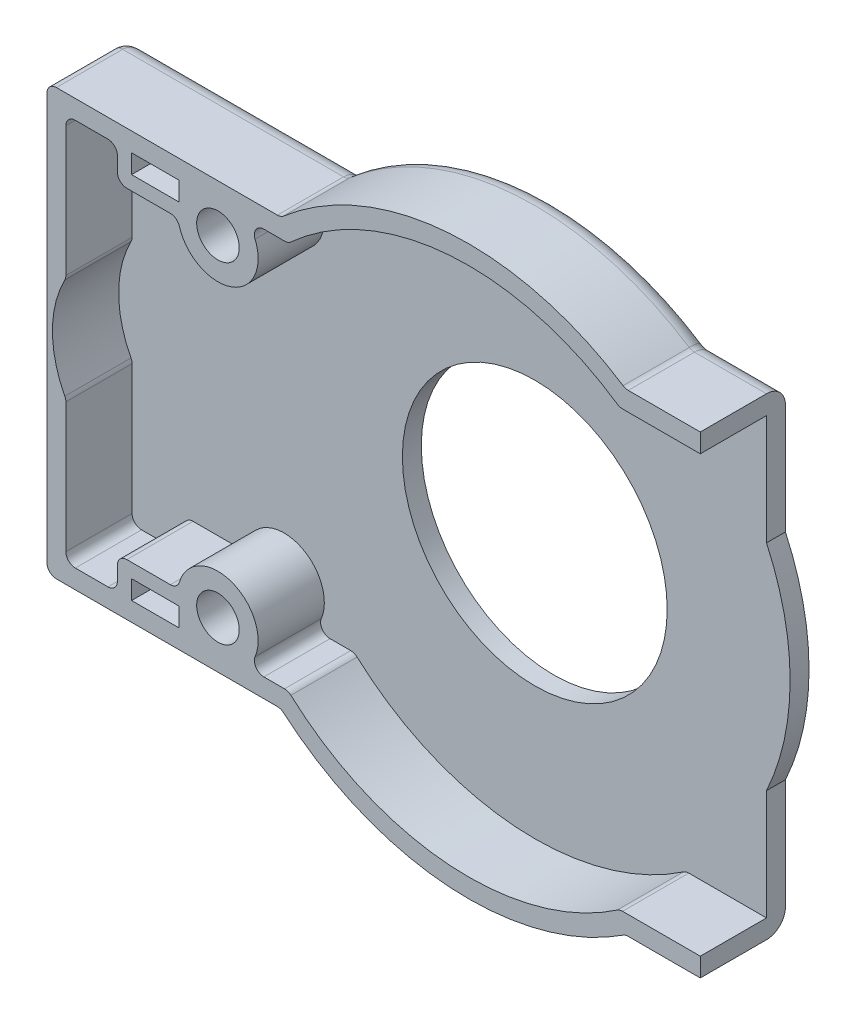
SolidWorks part; units mm, degrees
ref_plane "Спереди" through (0, 0, 0) normal (0, 0, 1) x (1, 0, 0)
ref_plane "Сверху" through (0, 0, 0) normal (0, 1, 0) x (1, 0, 0)
ref_plane "Справа" through (0, 0, 0) normal (1, 0, 0) x (0, 0, -1)
sketch "Эскиз1" plane through (0, 0, 0) normal (0, 0, 1) x (1, 0, 0)
  line L0 (0, 0) -> (24.5, 0) construction
  line L1 (24.5, -25) -> (24.5, -11.3468)
  line L2 (24.5, 25) -> (16.5831, 25)
  line L3 (24.5, -25) -> (16.5831, -25)
  line L4 (16.5831, 25) -> (-16.5831, 25) construction
  line L5 (16.5831, -25) -> (-16.5831, -25) construction
  line L6 (-16.5831, -22.5) -> (-16.5831, 22.5) construction
  line L7 (-16.5831, 0) -> (0, 0) construction
  line L8 (-16.5831, 22.5) -> (-19.8431, 22.5) construction
  line L9 (-16.5831, -22.5) -> (-19.8431, -22.5) construction
  line L10 (-19.8431, 22.5) -> (-44.5831, 22.5)
  line L11 (-44.5831, 22.5) -> (-44.5831, -22.5)
  line L12 (-44.5831, -22.5) -> (-19.8431, -22.5)
  line L13 (-44.5831, 0) -> (-16.5831, 0) construction
  line L17 (0, 30) -> (0, -30) construction
  line L23 (24.5, 11.3468) -> (24.5, 25)
  line L24 (24.5, 11.3468) -> (24.5, 0) construction
  line L25 (24.5, 0) -> (24.5, -11.3468) construction
  circle A0 centre (0, 0) radius 30 construction
  arc A1 (16.5831, 25) -> (-19.8431, 22.5) centre (0, 0) ccw
  arc A2 (-19.8431, -22.5) -> (16.5831, -25) centre (0, 0) ccw
  circle A7 centre (0, 0) radius 14
  arc A11 (24.5, 11.3468) -> (24.5, -11.3468) centre (0, 0) cw
  point P7 (24.5, 0)
  point P15 (-16.5831, 0)
  dimension "D1" = 60
  dimension "D4" = 45
  dimension "D6" = 28
  dimension "D11" = 27
  dimension "D2" = 50
  dimension "D3" = 24.5
  dimension "D5" = 28
extrude "Бобышка-Вытянуть1" add sketch "Эскиз1" along normal blind 2 contours L10 L11 L12 A2 L3 L1 L2 A1
sketch "Эскиз2" plane through (0, 0, 2) normal (0, 0, 1) x (1, 0, 0)
  line L7 (24.5, 25) -> (16.5831, 25) construction
  line L10 (16.5831, -25) -> (24.5, -25) construction
  line L11 (-44.5831, -22.5) -> (-19.8431, -22.5) construction
  line L12 (-44.5831, 22.5) -> (-44.5831, -22.5) construction
  line L13 (-19.8431, 22.5) -> (-44.5831, 22.5) construction
  line L21 (24.5, 25) -> (16.5831, 25)
  line L24 (16.5831, -25) -> (24.5, -25)
  line L25 (-44.5831, -22.5) -> (-19.8431, -22.5)
  line L26 (-44.5831, 22.5) -> (-44.5831, -22.5)
  line L27 (-19.8431, 22.5) -> (-44.5831, 22.5)
  line L28 (-19.0722, 20.5) -> (-42.5831, 20.5)
  line L29 (-42.5831, 20.5) -> (-42.5831, -20.5)
  line L30 (-42.5831, -20.5) -> (-19.0722, -20.5)
  line L31 (15.9687, -23) -> (24.5, -23)
  line L34 (24.5, 23) -> (15.9687, 23)
  line L36 (24.5, 11.3468) -> (24.5, 25) construction
  line L37 (24.5, 23) -> (24.5, 25)
  line L39 (24.5, -25) -> (24.5, -11.3468) construction
  line L40 (24.5, -23) -> (24.5, -25)
  line L42 (25.1156, 23) -> (24.5, 23) construction
  line L43 (24.7004, 25) -> (24.5, 25) construction
  line L44 (24.5, -23) -> (25.8064, -23) construction
  line L45 (24.5, -25) -> (25.4219, -25) construction
  arc A7 (16.5831, 25) -> (-19.8431, 22.5) centre (0, 0) ccw construction
  arc A9 (-19.8431, -22.5) -> (16.5831, -25) centre (0, 0) ccw construction
  arc A10 (16.5831, 25) -> (-19.8431, 22.5) centre (0, 0) ccw
  arc A12 (-19.8431, -22.5) -> (16.5831, -25) centre (0, 0) ccw
  arc A13 (-19.0722, -20.5) -> (15.9687, -23) centre (0, 0) ccw
  arc A22 (15.9687, 23) -> (-19.0722, 20.5) centre (0, 0) ccw
  arc A42 (25.8064, -23) -> (25.1156, 23) centre (35.2517, 0.147) ccw construction
  arc A43 (25.4219, -25) -> (24.7004, 25) centre (35.2517, 0.147) ccw construction
  dimension "D1" = 2
extrude "Бобышка-Вытянуть2" add sketch "Эскиз2" along normal blind 7
sketch "Эскиз3" plane through (0, 0, 2) normal (0, 0, 1) x (1, 0, 0)
  line L0 (-26.5031, 0) -> (-44.5831, 0) construction
  line L1 (-44.5831, 22.5) -> (-44.5831, -22.5) construction
  line L2 (-26.5031, 0) -> (-26.5031, 17.5) construction
  line L3 (-26.5031, 0) -> (-26.5031, -17.5) construction
  circle A0 centre (-26.5031, 17.5) radius 4.25
  circle A1 centre (-26.5031, -17.5) radius 4.25
  dimension "D3" = 8.5
  dimension "D1" = 35
  dimension "D2" = 18.08
extrude "Бобышка-Вытянуть3" add sketch "Эскиз3" along normal up to surface (7 mm away)
sketch "Эскиз4" plane through (0, 0, 9) normal (0, 0, 1) x (1, 0, 0)
  circle A0 centre (-26.5031, 17.5) radius 2.25
  circle A1 centre (-26.5031, -17.5) radius 2.25
  dimension "D1" = 4.5
extrude "Вырез-Вытянуть1" cut sketch "Эскиз4" against normal through all
sketch "Эскиз5" plane through (0, 0, 2) normal (0, 0, 1) x (1, 0, 0)
  line L0 (-44.5831, 0) -> (-32.5031, 0) construction
  line L2 (-44.5831, 22.5) -> (-44.5831, -22.5) construction
  circle A0 centre (-32.5031, 0) radius 11.5
  dimension "D2" = 23
  dimension "D1" = 12.08
extrude "Вырез-Вытянуть2" cut sketch "Эскиз5" along normal up to surface (7 mm away)
chamfer "Фаска1" distance 2.5 angle 45 2 edges at (-24.2531, -17.5, 0) (-24.2531, 17.5, 0)
sketch "Эскиз6" plane through (0, 0, 2) normal (0, 0, 1) x (1, 0, 0)
  line L0 (0, 0) -> (0, 25) construction
  line L1 (0, 25) -> (-44.5831, 25) construction
  line L2 (-44.5831, 25) -> (-44.5831, 0) construction
  line L3 (-44.5831, 22.5) -> (-44.5831, -22.5) construction
  line L4 (-42.5831, 20.5) -> (-29.5135, 20.5) construction
  line L5 (-37.1338, 17) -> (-29.1338, 17)
  line L6 (-35.6338, 20.5) -> (-30.6338, 20.5)
  line L7 (-35.6338, 20.5) -> (-35.6338, 18.5)
  line L8 (-35.6338, 18.5) -> (-30.6338, 18.5)
  line L9 (-30.6338, 20.5) -> (-30.6338, 18.5)
  line L10 (-29.1338, 22) -> (-29.1338, 17)
  line L11 (-37.1338, 22) -> (-29.1338, 22)
  line L12 (-37.1338, 22) -> (-37.1338, 17)
  line L13 (-44.5831, 0) -> (0, 0) construction
  line L14 (-30.6338, -20.5) -> (-30.6338, -18.5)
  line L15 (-35.6338, -18.5) -> (-30.6338, -18.5)
  line L16 (-35.6338, -20.5) -> (-35.6338, -18.5)
  line L17 (-35.6338, -20.5) -> (-30.6338, -20.5)
  line L18 (-37.1338, -22) -> (-37.1338, -17)
  line L19 (-37.1338, -22) -> (-29.1338, -22)
  line L20 (-37.1338, -17) -> (-29.1338, -17)
  line L21 (-29.1338, -22) -> (-29.1338, -17)
  arc A0 (-29.5135, 20.5) -> (-23.4927, 20.5) centre (-26.5031, 17.5) ccw construction
  dimension "D1" = 25
  dimension "D2" = 5
  dimension "D3" = 2
  dimension "D4" = 1.5
extrude "Бобышка-Вытянуть4" add sketch "Эскиз6" along normal up to surface (7 mm away)
fillet "Скругление3" radius 1 24 edges at (16.5831, -25, 4.5) (-19.8431, -22.5, 4.5) (16.5831, 25, 4.5) (-19.8431, 22.5, 4.5) (-44.5831, -22.5, 4.5) (-44.5831, 22.5, 4.5) (-42.5831, 20.5, 5.5) (-42.5831, -20.5, 5.5) (-19.0722, -20.5, 5.5) (15.9687, -23, 5.5) (15.9687, 23, 5.5) (-19.0722, 20.5, 5.5) (-23.4927, 20.5, 5.5) (-23.4927, -20.5, 5.5) (-42.5831, 5.5357, 5.5) (-42.5831, -5.5357, 5.5) (-29.1338, 17, 2.0361) (-37.1338, 20.5, 5.5) (-37.1338, 17, 5.5) (-37.1338, -20.5, 5.5) (-29.1338, -17, 2.0361) (-37.1338, -17, 5.5) (-30.7236, -17, 5.5) (-30.7236, 17, 5.5)
fillet "Скругление4" radius 2 13 edges at (16.598, 25.0412, 0) (20.691, 25, 0) (20.691, -25, 0) (16.598, -25.0412, 0) (-2.017, -29.9321, 0) (-19.8698, -22.5624, 0) (-31.9003, -22.5, 0) (-44.2902, -22.2071, 0) (-44.5831, 0, 0) (-44.2902, 22.2071, 0) (-31.9003, 22.5, 0) (-19.8698, 22.5624, 0) (-2.017, 29.9321, 0)
